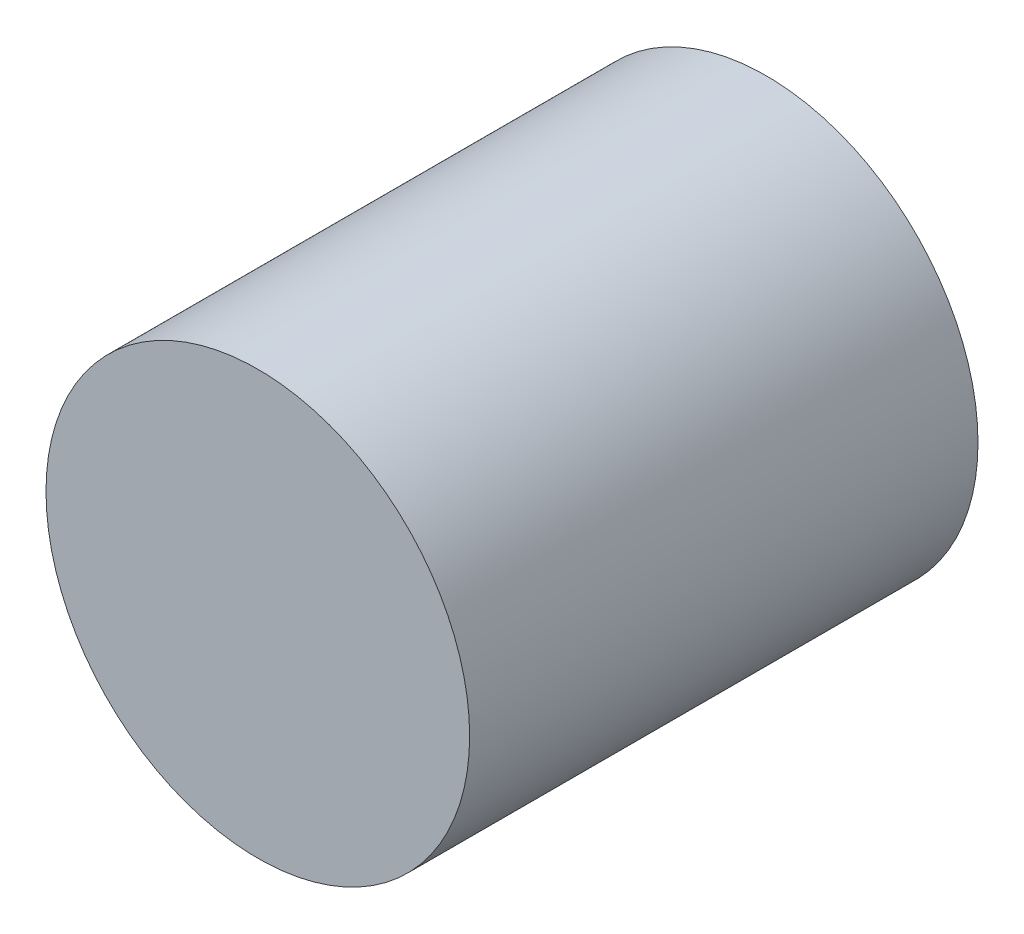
SolidWorks part; units mm, degrees
ref_plane "Front" through (0, 0, 0) normal (0, 0, 1) x (1, 0, 0)
ref_plane "Top" through (0, 0, 0) normal (0, 1, 0) x (1, 0, 0)
ref_plane "Right" through (0, 0, 0) normal (1, 0, 0) x (0, 0, -1)
sketch "Esquisse1" plane through (0, 0, 0) normal (0, 0, 1) x (1, 0, 0)
  circle A0 centre (0, 0) radius 6.25
  dimension "D1" = 12.5
extrude "Boss.-Extru.1" add sketch "Esquisse1" along normal blind 15
sketch "Esquisse2" plane through (0, 0, 15) normal (0, 0, 1) x (1, 0, 0)
  point P0 (0, 0)
